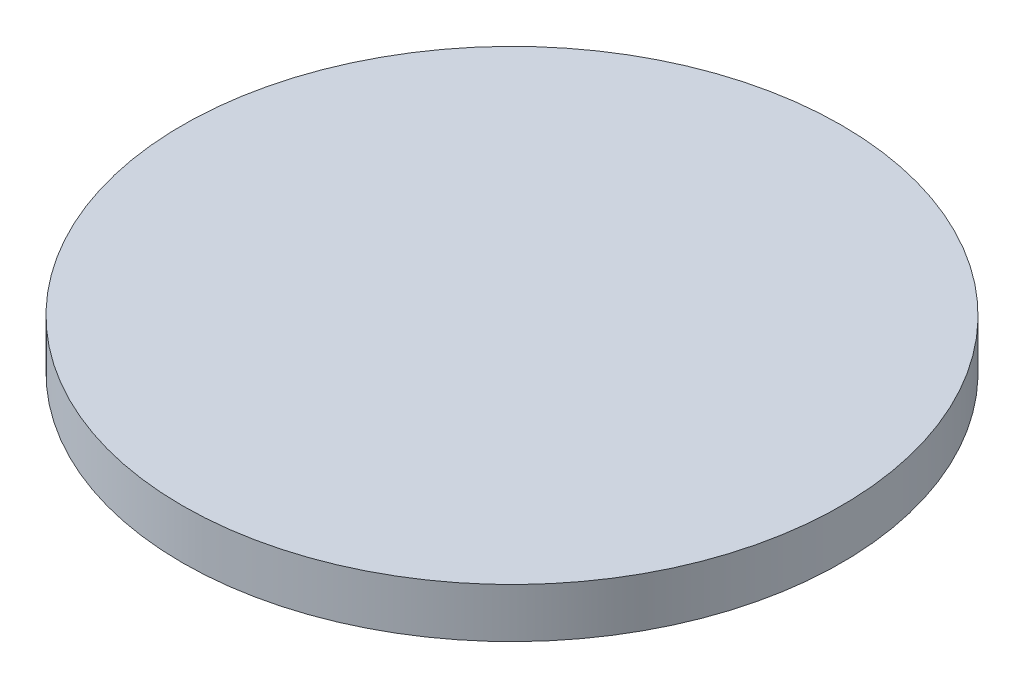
SolidWorks part; units mm, degrees
ref_plane "Front Plane" through (0, 0, 0) normal (0, 0, 1) x (1, 0, 0)
ref_plane "Top Plane" through (0, 0, 0) normal (0, 1, 0) x (1, 0, 0)
ref_plane "Right Plane" through (0, 0, 0) normal (1, 0, 0) x (0, 0, -1)
sketch "Sketch1" plane through (0, 0, 0) normal (0, 1, 0) x (1, 0, 0)
  circle A0 centre (0, 0) radius 29.38
  dimension "D1" = 58.76
extrude "Boss-Extrude1" add sketch "Sketch1" along normal blind 4.41 contours A0
